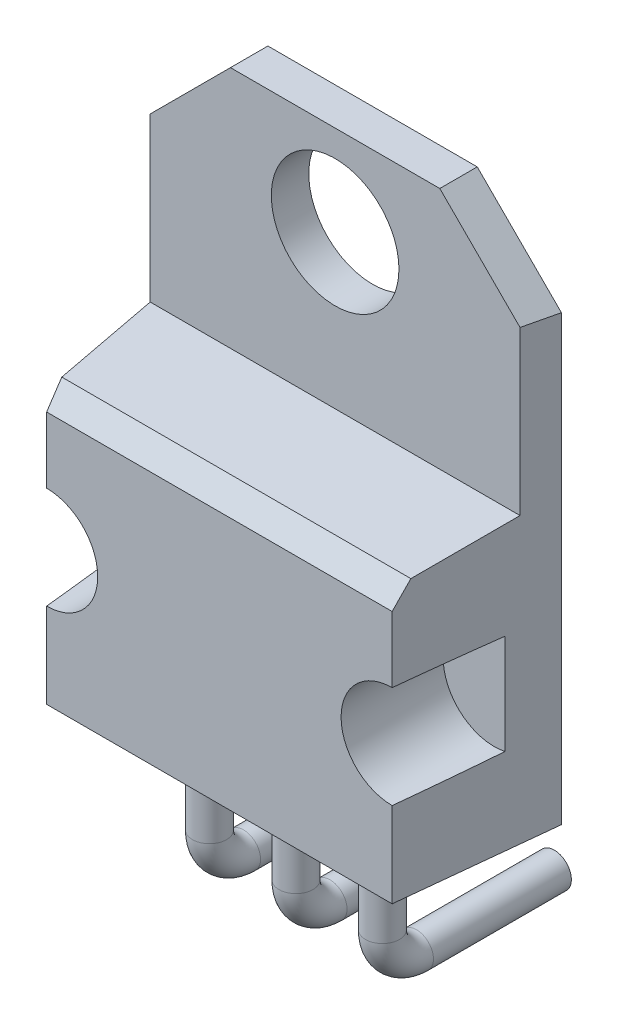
SolidWorks part; units mm, degrees
ref_plane "Face" through (0, 0, 0) normal (0, 0, 1) x (1, 0, 0)
ref_plane "Dessus" through (0, 0, 0) normal (0, 1, 0) x (1, 0, 0)
ref_plane "Droite" through (0, 0, 0) normal (1, 0, 0) x (0, 0, -1)
sketch "Esquisse1" plane through (0, 0, 0) normal (0, 0, 1) x (1, 0, 0)
  line L1 (0, 0) -> (10.15, 0)
  line L2 (0, 0) -> (0, 15.5)
  line L3 (0, 15.5) -> (10.15, 15.5)
  line L4 (10.15, 0) -> (10.15, 15.5)
  dimension "D1" = 10.15
  dimension "D2" = 15.5
extrude "Extrusion1" add sketch "Esquisse1" along normal blind 1.1
sketch "Esquisse2" plane through (0, 0, 1.1) normal (0, 0, 1) x (1, 0, 0)
  line L0 (5.075, 15.5) -> (5.075, 0) construction
  line L1 (10.15, 15.5) -> (0, 15.5) construction
  line L2 (0, 0) -> (10.15, 0) construction
  circle A0 centre (5.075, 12.85) radius 1.875
  dimension "D1" = 3.75
  dimension "D2" = 2.65
extrude "Enlèv. mat.-Extru.1" cut sketch "Esquisse2" against normal through all
chamfer "Chanfrein1" distance 2 angle 45 2 edges at (10.15, 15.5, 0.55) (0, 15.5, 0.55)
sketch "Esquisse3" plane through (0, 0, 1.1) normal (0, 0, 1) x (1, 0, 0)
  line L0 (10.15, 0) -> (10.15, 13.5) construction
  line L1 (0, 0) -> (10.15, 0)
  line L2 (0, 0) -> (0, 8)
  line L3 (0, 8) -> (10.15, 8)
  line L4 (10.15, 0) -> (10.15, 8)
  dimension "D1" = 8
extrude "Extrusion2" add sketch "Esquisse3" along normal blind 3.4
sketch "Esquisse4" plane through (0, 0, 4.5) normal (0, 0, 1) x (1, 0, 0)
  line L0 (0, 8) -> (0, 0) construction
  line L1 (10.15, 0) -> (10.15, 8) construction
  circle A0 centre (0, 4) radius 1.5
  circle A1 centre (10.15, 4) radius 1.5
  dimension "D1" = 3
extrude "Enlèv. mat.-Extru.2" cut sketch "Esquisse4" against normal blind 3
draft "Dépouille1" type of draft neutral plane draft angle 6 faces to draft 3 parameters "D1"=6
chamfer "Chanfrein2" distance 0.5 angle 45 1 edges at (5.075, 8, 4.5)
sketch "Esquisse5" plane through (0, 0, 0) normal (0, -1, 0) x (1, 0, 0)
  line L0 (10.3865, 2.25) -> (-0.2365, 2.25) construction
  line L1 (10.15, 4.5) -> (10.623, 0) construction
  line L2 (0, 4.5) -> (-0.473, 0) construction
  line L3 (5.075, 4.5) -> (5.075, 0) construction
  line L4 (0, 4.5) -> (10.15, 4.5) construction
  line L5 (-0.473, 0) -> (10.623, 0) construction
  line L6 (2.535, 5.0368) -> (2.535, -1.1934) construction
  circle A2 centre (2.535, 2.25) radius 0.5
  dimension "D1" = 2.54
ref_plane "Plan1" through (2.54, 0, 0) normal (1, 0, 0) x (0, 0, -1)
sketch "Esquisse8" plane through (2.54, 0, 0) normal (1, 0, 0) x (0, 0, -1)
  line L0 (0, -0.3289) -> (0, -5.6814) construction
  line L1 (4.6795, -4.05) -> (-3.597, -4.05) construction
  line L2 (4.9238, 0) -> (-3.2267, 0) construction
  line L3 (-2.25, 1.186) -> (-2.25, -5.6814) construction
  line L4 (-2.25, 0) -> (-2.25, -3.05)
  line L5 (-1.25, -4.05) -> (2.8, -4.05)
  line L6 (2.8, -5.6814) -> (2.8, 2.0062) construction
  arc A0 (-2.25, -3.05) -> (-1.25, -4.05) centre (-1.25, -3.05) ccw
  dimension "D3" = 1
  dimension "D1" = 2.25
  dimension "D2" = 4.05
  dimension "D4" = 2.8
sweep "Balayage1" add profiles "Esquisse5" path "Esquisse8"
sketch "Esquisse9" plane through (0, 0, 0) normal (0, -1, 0) x (1, 0, 0)
  line L0 (5.075, -0.3913) -> (5.075, 6.4257) construction
  line L1 (-2.5677, 0) -> (13.037, 0) construction
  line L2 (13.037, 2.25) -> (-3.6328, 2.25) construction
  circle A0 centre (5.075, 2.25) radius 0.5
  dimension "D1" = 2.25
ref_plane "Plan2" through (5.075, 0, 0) normal (1, 0, 0) x (0, 0, -1)
sketch "Esquisse10" plane through (5.075, 0, 0) normal (1, 0, 0) x (0, 0, -1)
  line L1 (3.5231, -4.05) -> (-3.8327, -4.05) construction
  line L2 (-2.25, 0.8142) -> (-2.25, -6.301) construction
  line L3 (-2.25, 0) -> (-2.25, -3.05)
  line L4 (-1.25, -4.05) -> (2.8, -4.05)
  line L5 (-1.25, -4.05) -> (2.8, -4.05) construction
  line L6 (2.8, -5.2117) -> (2.8, -2.1485) construction
  arc A0 (-2.25, -3.05) -> (-1.25, -4.05) centre (-1.25, -3.05) ccw
  dimension "D1" = 1
sweep "Balayage2" add profiles "Esquisse9" path "Esquisse10"
mirror "Symétrie1" about plane through (5.075, 0, 0) normal (1, 0, 0) of "Balayage1"
